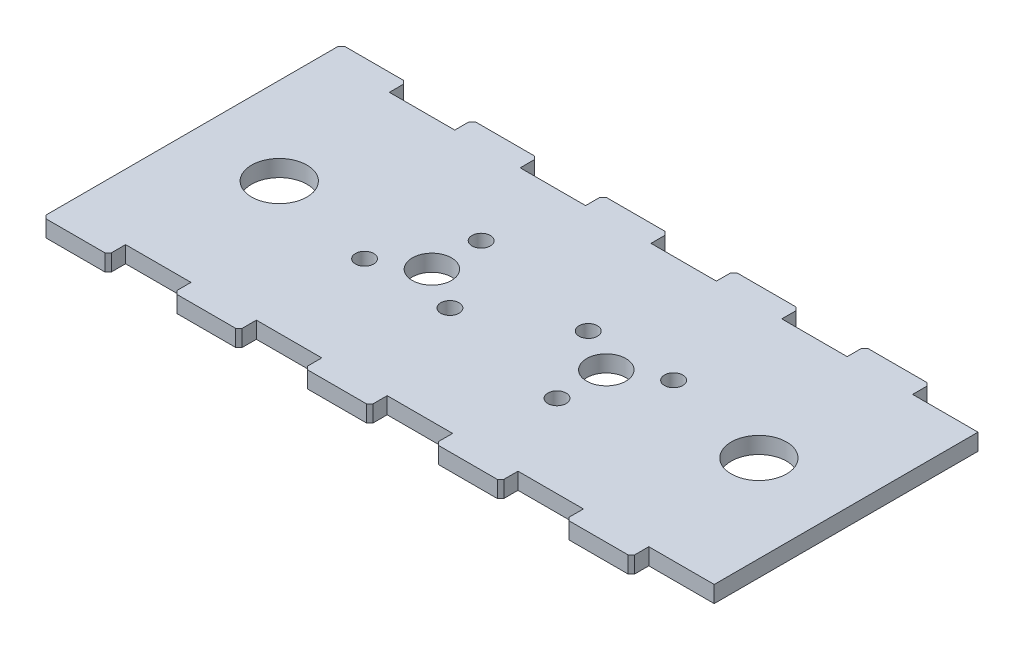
SolidWorks part; units mm, degrees
ref_plane "Front Plane" through (0, 0, 0) normal (0, 0, 1) x (1, 0, 0)
ref_plane "Top Plane" through (0, 0, 0) normal (0, 1, 0) x (1, 0, 0)
ref_plane "Right Plane" through (0, 0, 0) normal (1, 0, 0) x (0, 0, -1)
sketch "panel" plane through (0, 0, 0) normal (0, 1, 0) x (1, 0, 0)
  line L0 (20, 60.5) -> (20, 0) construction
  line L1 (0, 0) -> (150, 0)
  line L2 (0, 0) -> (0, 60.5)
  line L3 (0, 60.5) -> (150, 60.5)
  line L4 (150, 0) -> (150, 60.5)
  line L5 (55, 60.5) -> (55, 0) construction
  line L6 (95, 60.5) -> (95, 0) construction
  line L7 (130, 60.5) -> (130, 0) construction
  circle A0 centre (55, 30.25) radius 4.5
  circle A1 centre (55, 41.55) radius 2.1
  circle A2 centre (64.7861, 24.6) radius 2.1
  circle A3 centre (45.2139, 24.6) radius 2.1
  circle A4 centre (95, 30.25) radius 4.5
  circle A5 centre (95, 18.95) radius 2.1
  circle A6 centre (85.2139, 35.9) radius 2.1
  circle A7 centre (104.7861, 35.9) radius 2.1
  circle A8 centre (20, 30.25) radius 6.35
  circle A9 centre (130, 30.25) radius 6.35
  point P24 (55, 30.25)
  point P33 (95, 30.25)
  dimension "screwgear" = 9
  dimension "D4" = 9
  dimension "mountscrew" = 4.2
  dimension "D5" = 4.2
  dimension "D8" = 12.7
  dimension "bushingOD" = 12.7
  dimension "D1" = 20
  dimension "edge" = 20
  dimension "D2" = 35
  dimension "screw" = 35
  dimension "motor" = 75
  dimension "motorlength" = 60.5
  dimension "screwmountspace" = 11.3
  dimension "D6" = 11.3
  dimension "screwarray" = 3
  dimension "D7" = 3
extrude "panelx3" add sketch "panel" along normal blind 3.81
sketch "Sketch3" plane through (0, 3.81, 0) normal (0, 1, 0) x (1, 0, 0)
  line L0 (0, 30.25) -> (150, 30.25) construction
  line L1 (0, 60.5) -> (15, 60.5)
  line L2 (0, 60.5) -> (0, 64.5)
  line L3 (0, 64.5) -> (15, 64.5)
  line L4 (15, 60.5) -> (15, 64.5)
  line L5 (0, 60.5) -> (0, 0) construction
  line L6 (150, 0) -> (150, 60.5) construction
  line L7 (15, 0) -> (15, -4)
  line L8 (0, -4) -> (15, -4)
  line L9 (0, 0) -> (0, -4)
  line L10 (0, 0) -> (15, 0)
  line L11 (30, 60.5) -> (45, 60.5)
  line L12 (30, 60.5) -> (30, 64.5)
  line L13 (30, 64.5) -> (45, 64.5)
  line L14 (45, 60.5) -> (45, 64.5)
  line L15 (45, 0) -> (45, -4)
  line L16 (30, -4) -> (45, -4)
  line L17 (30, 0) -> (30, -4)
  line L18 (30, 0) -> (45, 0)
  line L19 (60, 60.5) -> (75, 60.5)
  line L20 (60, 60.5) -> (60, 64.5)
  line L21 (60, 64.5) -> (75, 64.5)
  line L22 (75, 60.5) -> (75, 64.5)
  line L23 (75, 0) -> (75, -4)
  line L24 (60, -4) -> (75, -4)
  line L25 (60, 0) -> (60, -4)
  line L26 (60, 0) -> (75, 0)
  line L27 (90, 60.5) -> (105, 60.5)
  line L28 (90, 60.5) -> (90, 64.5)
  line L29 (90, 64.5) -> (105, 64.5)
  line L30 (105, 60.5) -> (105, 64.5)
  line L31 (105, 0) -> (105, -4)
  line L32 (90, -4) -> (105, -4)
  line L33 (90, 0) -> (90, -4)
  line L34 (90, 0) -> (105, 0)
  line L35 (120, 60.5) -> (135, 60.5)
  line L36 (120, 60.5) -> (120, 64.5)
  line L37 (120, 64.5) -> (135, 64.5)
  line L38 (135, 60.5) -> (135, 64.5)
  line L39 (135, 0) -> (135, -4)
  line L40 (120, -4) -> (135, -4)
  line L41 (120, 0) -> (120, -4)
  line L42 (120, 0) -> (135, 0)
  dimension "D1" = 5
  dimension "thickness" = 4
  dimension "tab" = 15
extrude "Boss-Extrude4" add sketch "Sketch3" against normal up to surface (3.81 mm away)
chamfer "Chamfer1" distance 0.75 angle 45 20 edges at (135, 1.905, -64.5) (120, 1.905, -64.5) (105, 1.905, -64.5) (90, 1.905, -64.5) (75, 1.905, -64.5) (60, 1.905, -64.5) (45, 1.905, -64.5) (30, 1.905, -64.5) (15, 1.905, -64.5) (0, 1.905, -64.5) (0, 1.905, 4) (30, 1.905, 4) (60, 1.905, 4) (90, 1.905, 4) (120, 1.905, 4) (135, 1.905, 4) (105, 1.905, 4) (75, 1.905, 4) (45, 1.905, 4) (15, 1.905, 4)
